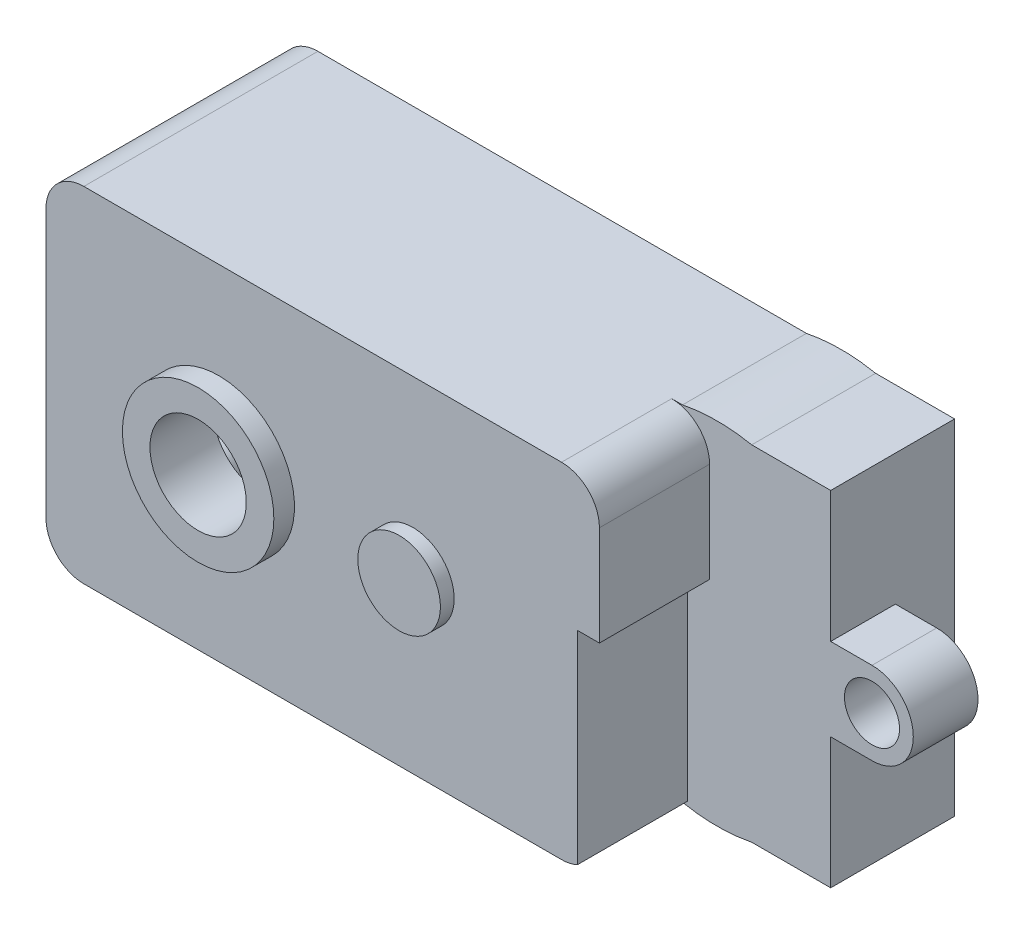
SolidWorks part; units mm, degrees
ref_plane "Plan de face" through (0, 0, 0) normal (0, 0, 1) x (1, 0, 0)
ref_plane "Plan de dessus" through (0, 0, 0) normal (0, 1, 0) x (1, 0, 0)
ref_plane "Plan de droite" through (0, 0, 0) normal (1, 0, 0) x (0, 0, -1)
sketch "Esquisse3" plane through (0, 0, 0) normal (0, 0, 1) x (1, 0, 0)
  line L0 (-5.7375, 0) -> (0, 0)
  line L1 (-10.7625, 0) -> (-49, 0)
  line L2 (-49, 0) -> (-49, 25)
  line L3 (-10.7625, 25) -> (-49, 25)
  line L8 (0, 25) -> (-5.7375, 25)
  line L11 (0, 0) -> (0, 25)
  arc A1 (-5.7375, 25) -> (-10.7625, 25) centre (-8.25, 12.5) ccw
  arc A7 (-10.7625, 0) -> (-5.7375, 0) centre (-8.25, 12.5) ccw
extrude "Extrusion3" add sketch "Esquisse3" along normal blind 9 separate body
sketch "Esquisse5" plane through (0, 0, 9) normal (0, 0, 1) x (1, 0, 0)
  line L1 (-11.55, 0) -> (-49, 0)
  line L2 (-49, 0) -> (-49, 25)
  line L3 (0, 25) -> (-5.7375, 25) construction
  line L4 (-8.8, 22.25) -> (-8.8, 2.75)
  line L5 (-5.7375, 0) -> (0, 0) construction
  line L6 (-49, 25) -> (-11.55, 25)
  arc A4 (-8.8, 2.75) -> (-11.55, 0) centre (-11.55, 2.75) cw
  arc A5 (-11.55, 25) -> (-8.8, 22.25) centre (-11.55, 22.25) cw
  point P14 (-8.8, 0)
  point P17 (-8.8, 25)
  dimension "D2" = 2.75
extrude "Extrusion4" add sketch "Esquisse5" along normal blind 8
sketch "Esquisse6" plane through (0, 0, 17) normal (0, 0, 1) x (1, 0, 0)
  line L1 (-10.4, 15) -> (-6.7347, 15)
  line L2 (-10.4, 15) -> (-10.4, 0)
  line L3 (-10.4, 0) -> (-6.7347, 0)
  line L4 (-6.7347, 15) -> (-6.7347, 0)
  dimension "D2" = 15
extrude "Enlèv. mat.-Extru.2" cut sketch "Esquisse6" against normal blind 8
shell "Coque1" thickness 1
fillet "Congé2" radius 2.75 2 edges at (-49, 25, 8.5) (-49, 0, 8.5)
sketch "Esquisse8" plane through (0, 0, 15.5) normal (0, 0, -1) x (-1, 0, 0)
  circle A2 centre (22.35, 12.5) radius 3
  dimension "D2" = 6
  dimension "D1" = 22.35
  dimension "D3" = 12.5
extrude "Extrusion5" add sketch "Esquisse8" along normal blind 0.9
sketch "Esquisse9" plane through (0, 0, 17) normal (0, 0, 1) x (1, 0, 0)
  circle A0 centre (-22.35, 12.5) radius 3
  circle A1 centre (-22.35, 12.5) radius 3 construction
extrude "Extrusion6" add sketch "Esquisse9" along normal blind 1
sketch "Esquisse10" plane through (0, 0, 14.6) normal (0, 0, -1) x (-1, 0, 0)
  circle A0 centre (22.35, 12.5) radius 1.525
  circle A1 centre (22.35, 12.5) radius 3 construction
  dimension "D1" = 3.05
extrude "Enlèv. mat.-Extru.3" cut sketch "Esquisse10" against normal blind 2.8
sketch "Esquisse11" plane through (0, 0, 15.5) normal (0, 0, -1) x (-1, 0, 0)
  circle A0 centre (36.45, 12.5) radius 5.5
  circle A1 centre (22.35, 12.5) radius 3 construction
  dimension "D2" = 12.5
  dimension "D3" = 11
  dimension "D1" = 14.1
extrude "Extrusion7" add sketch "Esquisse11" along normal blind 1.6
sketch "Esquisse13" plane through (0, 0, 17) normal (0, 0, 1) x (1, 0, 0)
  circle A1 centre (-36.45, 12.5) radius 5.5
  circle A2 centre (-36.45, 12.5) radius 5.5
  dimension "D1" = 0
extrude "Extrusion8" add sketch "Esquisse13" along normal blind 1.5
sketch "Esquisse12" plane through (0, 0, 13.9) normal (0, 0, -1) x (-1, 0, 0)
  circle A0 centre (36.45, 12.5) radius 3.5
  circle A1 centre (36.45, 12.5) radius 5.5 construction
  dimension "D1" = 7
extrude "Enlèv. mat.-Extru.4" cut sketch "Esquisse12" against normal through all
sketch "Esquisse14" plane through (0, 0, 15.5) normal (0, 0, -1) x (-1, 0, 0)
  line L1 (10.6609, 24) -> (48, 24) construction
  line L2 (48, 1) -> (10.6609, 1) construction
  line L3 (48, 24) -> (48, 1) construction
  line L4 (48, 1) -> (46.25, 1)
  line L5 (48, 24) -> (48, 22.25)
  line L6 (46.25, 24) -> (48, 24)
  line L7 (48, 2.75) -> (48, 1)
  arc A0 (46.25, 24) -> (48, 22.25) centre (46.25, 22.25) ccw
  arc A1 (48, 2.75) -> (46.25, 1) centre (46.25, 2.75) ccw
  arc A2 (49, 22.25) -> (46.25, 25) centre (46.25, 22.25) ccw construction
  arc A3 (46.25, 0) -> (49, 2.75) centre (46.25, 2.75) ccw construction
  circle A4 centre (46.25, 22.25) radius 0.75
  circle A5 centre (46.25, 2.75) radius 0.75
  dimension "D1" = 1.5
extrude "Extrusion9" add sketch "Esquisse14" along normal blind 14.2
sketch "Esquisse15" plane through (0, 0, 9) normal (0, 0, 1) x (1, 0, 0)
  line L0 (0, 0) -> (0, 25) construction
  line L1 (3, 15.5) -> (-2.6471, 15.5)
  line L2 (-2.6471, 9.5) -> (3, 9.5)
  line L3 (-2.6471, 15.5) -> (-2.6471, 9.5)
  arc A0 (3, 9.5) -> (3, 15.5) centre (3, 12.5) ccw
  circle A1 centre (3, 12.5) radius 1.25
  dimension "D2" = 6
  dimension "D3" = 2.5
  dimension "D1" = 12.5
extrude "Extrusion10" add sketch "Esquisse15" against normal blind 4.7
sketch "Esquisse16" plane through (0, 0, 9) normal (0, 0, 1) x (1, 0, 0)
  circle A0 centre (3, 12.5) radius 2
  circle A1 centre (3, 12.5) radius 1.25 construction
  dimension "D1" = 4
extrude "Enlèv. mat.-Extru.5" cut sketch "Esquisse16" against normal blind 4
